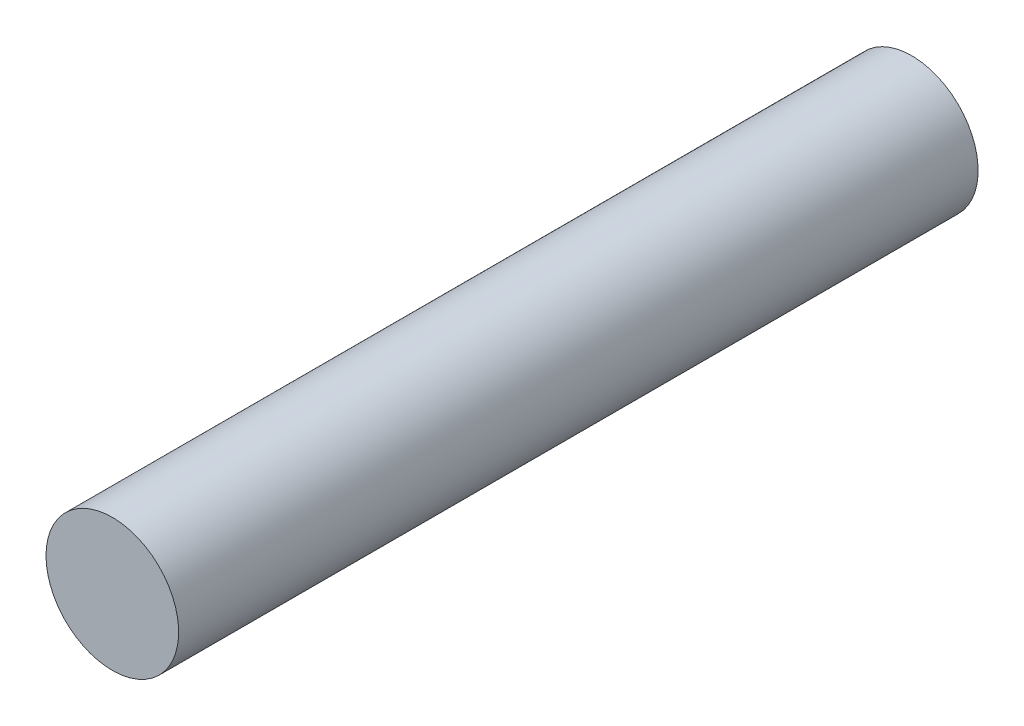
SolidWorks part; units mm, degrees
ref_plane "Front Plane" through (0, 0, 0) normal (0, 0, 1) x (1, 0, 0)
ref_plane "Top Plane" through (0, 0, 0) normal (0, 1, 0) x (1, 0, 0)
ref_plane "Right Plane" through (0, 0, 0) normal (1, 0, 0) x (0, 0, -1)
sketch "Sketch1" plane through (0, 0, 0) normal (0, 0, 1) x (1, 0, 0)
  circle A0 centre (0, 0) radius 38
  dimension "D1" = 76
extrude "Boss-Extrude1" add sketch "Sketch1" along normal mid plane 458
